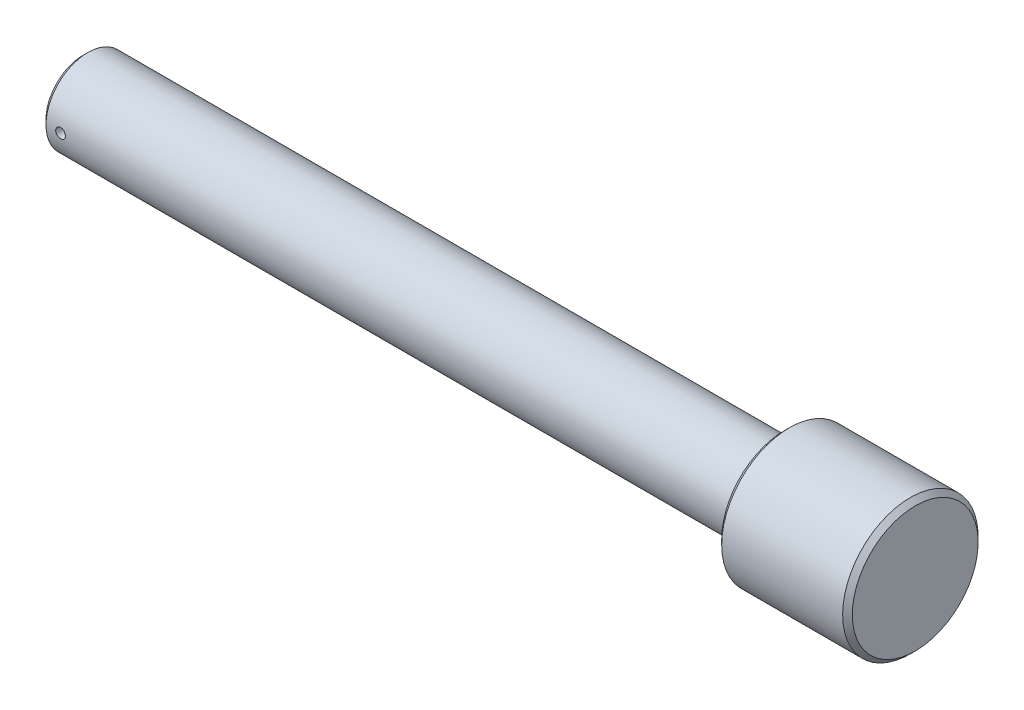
SolidWorks part; units mm, degrees
ref_plane "Plan de face" through (0, 0, 0) normal (0, 0, 1) x (1, 0, 0)
ref_plane "Plan de dessus" through (0, 0, 0) normal (0, 1, 0) x (1, 0, 0)
ref_plane "Plan de droite" through (0, 0, 0) normal (1, 0, 0) x (0, 0, -1)
sketch "Esquisse1" plane through (0, 0, 0) normal (0, 0, 1) x (1, 0, 0)
  line L0 (0, 0) -> (172, 0) construction
  line L1 (0, 0) -> (0, 7.65)
  line L2 (1, 8.65) -> (145, 8.65)
  line L3 (145, 8.65) -> (145, 13)
  line L4 (146, 14) -> (171, 14)
  line L5 (172, 13) -> (172, 0)
  line L6 (0, 7.65) -> (1, 8.65)
  line L7 (145, 13) -> (146, 14)
  line L8 (171, 14) -> (172, 13)
  line L9 (0, 0) -> (172, 0)
  point P4 (0, 8.65)
  point P6 (145, 14)
  point P7 (172, 14)
  dimension "D1" = 145
  dimension "D2" = 17.3
  dimension "D3" = 28
  dimension "D4" = 25
revolve "Révolution1" add sketch "Esquisse1" angle 360 about L0
sketch "Esquisse2" plane through (0, 0, 0) normal (0, 0, 1) x (1, 0, 0)
  circle A0 centre (4, 0) radius 1
  dimension "D1" = 2
  dimension "D2" = 4
extrude "Enlèv. mat.-Extru.1" cut sketch "Esquisse2" against normal through all and the other way through all
